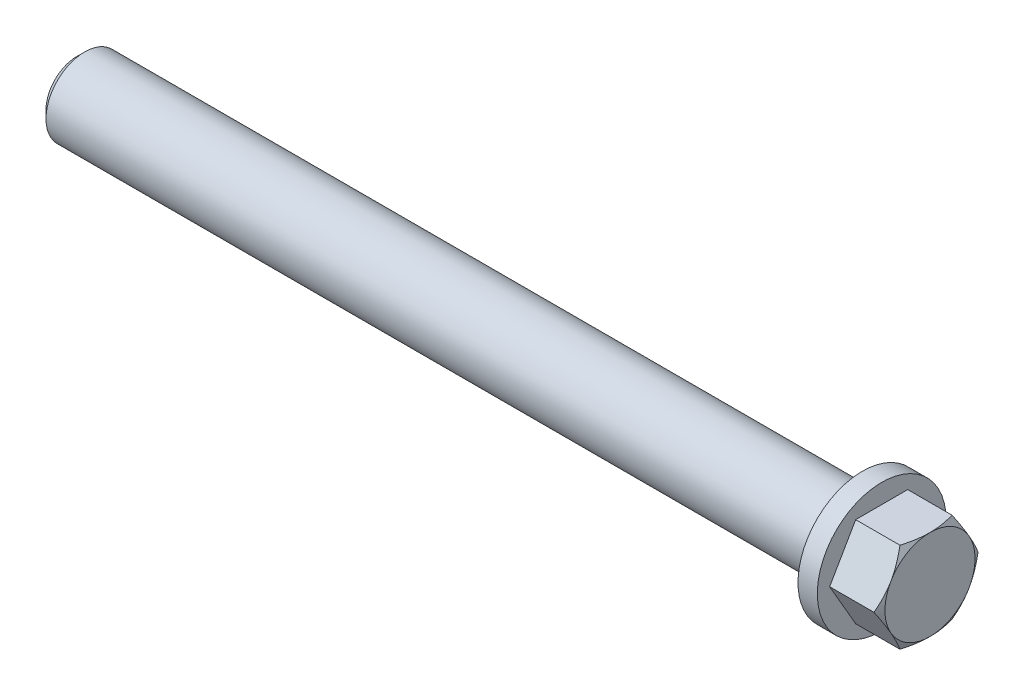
SolidWorks part; units mm, degrees
ref_plane "Face" through (0, 0, 0) normal (0, 0, 1) x (1, 0, 0)
ref_plane "Dessus" through (0, 0, 0) normal (0, 1, 0) x (1, 0, 0)
ref_plane "Droite" through (0, 0, 0) normal (1, 0, 0) x (0, 0, -1)
sketch "Esquisse1" plane through (0, 0, 0) normal (1, 0, 0) x (0, 0, -1)
  line L0 (8.0829, 0) -> (4.0415, 7)
  line L1 (4.0415, 7) -> (-4.0415, 7)
  line L2 (-4.0415, 7) -> (-8.0829, 0)
  line L3 (-8.0829, 0) -> (-4.0415, -7)
  line L4 (-4.0415, -7) -> (4.0415, -7)
  line L5 (4.0415, -7) -> (8.0829, 0)
  line L6 (0, 0) -> (31, 0) construction
  circle A0 centre (0, 0) radius 8.0829 construction
  dimension "D1" = 14
extrude "Base-Extrusion" add sketch "Esquisse1" along normal blind 7.5
sketch "Esquisse2" plane through (0, 0, 0) normal (-1, 0, 0) x (0, 0, 1)
  circle A0 centre (0, 0) radius 6
  dimension "D1" = 12
extrude "Boss.-Extru.1" add sketch "Esquisse2" along normal blind 125
sketch "Esquisse3" plane through (0, 0, 0) normal (0, 0, 1) x (1, 0, 0)
  line L0 (7.5, -7) -> (0, -19.9904)
  line L1 (0, -19.9904) -> (7.5, -19.9904)
  line L2 (7.5, -19.9904) -> (7.5, -7)
  line L3 (3.75, -13.4952) -> (7.5, -19.9904) construction
  line L4 (0, 0) -> (0, -7) construction
  line L5 (0, 0) -> (12.7759, 0) construction
  line L6 (-125, 0) -> (0, 0) construction
revolve "Enlèvement de matière-Révolution1" cut sketch "Esquisse3" angle 360 about L5
chamfer "Chanfrein1" distance 1.2 angle 45 1 edges at (-125, 0, 6)
sketch "Esquisse4" plane through (0, 0, 0) normal (0, 0, 1) x (1, 0, 0)
  line L0 (0, 0) -> (-110.7549, 0) construction
  line L2 (0, 0) -> (-3, 0)
  line L3 (0, 0) -> (0, 10)
  line L4 (0, 10) -> (-3, 10)
  line L5 (-3, 0) -> (-3, 10)
  dimension "D1" = 3
  dimension "D2" = 20
revolve "Révolution1" add sketch "Esquisse4" angle 360 about L0
sketch "Esquisse5" plane through (0, 0, 0) normal (0, 0, 1) x (1, 0, 0)
  line L0 (-3, 6) -> (-3, -6) construction
  line L1 (-3, 0) -> (-37, 0)
  line L2 (-3, 0) -> (-3, 6)
  line L3 (-3, 6) -> (-37, 6)
  line L4 (-37, 0) -> (-37, 6)
  line L5 (0, 0) -> (-308.1157, 0) construction
  dimension "D1" = 12
  dimension "D2" = 34
revolve "Révolution2" add sketch "Esquisse5" angle 360 about L5
fillet "Congé1" radius 1
equation "\"D2@Représentation de filetage1\" = 0.8*\"D1@Esquisse2\""
equation "\"D1@Chanfrein1\" = 0.1*\"D1@Esquisse2\""
